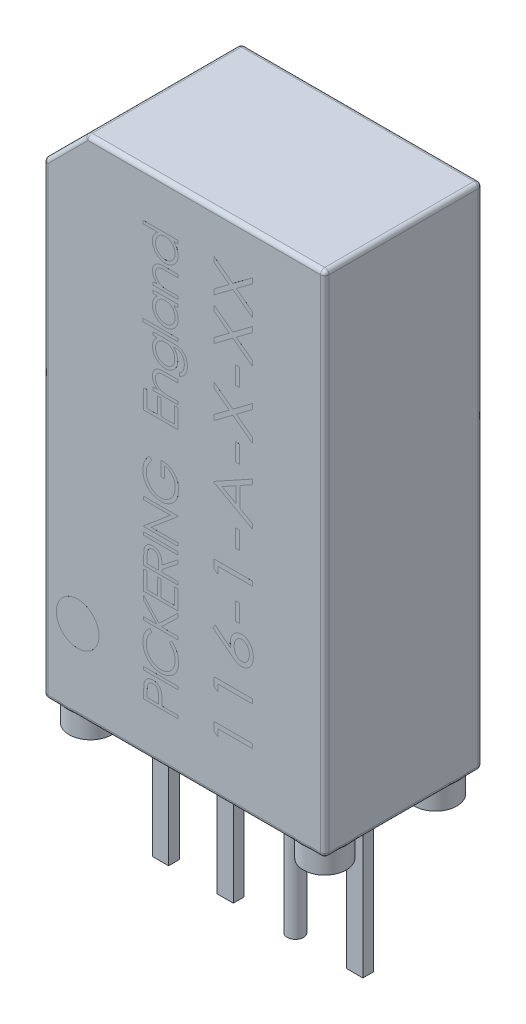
SolidWorks part; units mm, degrees
ref_plane "Front Plane" through (0, 0, 0) normal (0, 0, 1) x (1, 0, 0)
ref_plane "Top Plane" through (0, 0, 0) normal (0, 1, 0) x (1, 0, 0)
ref_plane "Right Plane" through (0, 0, 0) normal (1, 0, 0) x (0, 0, -1)
sketch "Sketch1" plane through (0, 0, 0) normal (0, 1, 0) x (1, 0, 0)
  line L1 (3.3, -1.85) -> (-3.3, -1.85)
  line L2 (3.3, -1.85) -> (3.3, 1.85)
  line L3 (3.3, 1.85) -> (-3.3, 1.85)
  line L4 (-3.3, -1.85) -> (-3.3, 1.85)
  line L5 (3.3, -1.85) -> (-3.3, 1.85) construction
  line L6 (3.3, 1.85) -> (-3.3, -1.85) construction
  point P0 (0, 0)
  dimension "D1" = 3.7
  dimension "D2" = 6.6
extrude "Main body" add sketch "Sketch1" along normal blind 11.942
sketch "Sketch2" plane through (0, 0, 1.85) normal (0, 0, 1) x (1, 0, 0)
  line L0 (-2.3, 11.942) -> (-3.3, 10.942)
  line L1 (-3.3, 11.942) -> (3.3, 11.942) construction
  line L2 (-3.3, 11.942) -> (-3.3, 0) construction
  line L3 (-3.3, 10.942) -> (-3.3, 11.942)
  line L4 (-3.3, 11.942) -> (-2.3, 11.942)
  dimension "D1" = 45
  dimension "D2" = 5.6
extrude "Box style cut" cut sketch "Sketch2" against normal through all
sketch "Sketch3" plane through (0, 0, 0) normal (0, -1, 0) x (1, 0, 0)
  line L0 (-3.3, 1.85) -> (3.3, 1.85) construction
  line L1 (-3.3, -1.85) -> (-3.3, 1.85) construction
  line L2 (3.3, -1.85) -> (-3.3, -1.85) construction
  line L3 (3.3, 1.85) -> (3.3, -1.85) construction
  circle A0 centre (-2.75, 1.3) radius 0.5
  circle A1 centre (-2.75, -1.3) radius 0.5
  circle A2 centre (2.75, -1.3) radius 0.5
  circle A3 centre (2.75, 1.3) radius 0.5
  dimension "D1" = 1
  dimension "D4" = 1
  dimension "D7" = 1
  dimension "D9" = 1
  dimension "D2" = 0.55
  dimension "D3" = 0.55
  dimension "D5" = 0.55
  dimension "D6" = 0.55
  dimension "D8" = 0.55
extrude "Feet" add sketch "Sketch3" along normal blind 0.508
sketch "Sketch4" plane through (0, 0, 0) normal (0, -1, 0) x (1, 0, 0)
  line L0 (-3.3, -1.85) -> (-3.3, 1.85) construction
  line L1 (-2.0895, -0.127) -> (-2.4705, -0.127)
  line L2 (-2.0895, -0.127) -> (-2.0895, 0.127)
  line L3 (-2.0895, 0.127) -> (-2.4705, 0.127)
  line L4 (-2.4705, -0.127) -> (-2.4705, 0.127)
  line L5 (-2.0895, -0.127) -> (-2.4705, 0.127) construction
  line L6 (-2.0895, 0.127) -> (-2.4705, -0.127) construction
  line L8 (-0.5695, -0.127) -> (-0.9505, -0.127)
  line L9 (-0.5695, -0.127) -> (-0.5695, 0.127)
  line L10 (-0.5695, 0.127) -> (-0.9505, 0.127)
  line L11 (-0.9505, -0.127) -> (-0.9505, 0.127)
  line L12 (-0.5695, -0.127) -> (-0.9505, 0.127) construction
  line L13 (-0.5695, 0.127) -> (-0.9505, -0.127) construction
  line L19 (2.4705, -0.127) -> (2.0895, -0.127)
  line L20 (2.4705, -0.127) -> (2.4705, 0.127)
  line L21 (2.4705, 0.127) -> (2.0895, 0.127)
  line L22 (2.0895, -0.127) -> (2.0895, 0.127)
  line L23 (2.4705, -0.127) -> (2.0895, 0.127) construction
  line L24 (2.4705, 0.127) -> (2.0895, -0.127) construction
  circle A0 centre (0.76, 0) radius 0.1905
  point P0 (-2.28, 0)
  point P7 (-0.76, 0)
  point P15 (2.28, 0)
  dimension "D3" = 0.381
  dimension "D1" = 0.381
  dimension "D2" = 0.254
  dimension "D4" = 1.52
  dimension "D5" = 0.381
  dimension "D6" = 1.52
  dimension "D7" = 0.381
  dimension "D8" = 0.254
  dimension "D9" = 1.52
  dimension "D12" = 1.02
extrude "Pins" add sketch "Sketch4" along normal blind 3.678
sketch "Sketch5" plane through (0, 0, 1.85) normal (0, 0, 1) x (1, 0, 0)
  line L0 (-0.15, 1.042) -> (-0.15, 11.042) construction
  line L1 (1.6, 1.042) -> (1.6, 11.042) construction
  line L2 (-2.3, 11.942) -> (3.3, 11.942) construction
  line L3 (-3.3, 10.942) -> (-3.3, 0) construction
  line L4 (-3.3, 0) -> (3.3, 0) construction
  circle A0 centre (-2.5, 1.9) radius 0.5
  text T0 "PICKERING   England" font "Century Gothic" height 0.8
  text T1 "116-1-A-X-XX" font "Century Gothic" height 0.9
  dimension "D5" = 1
  dimension "D1" = 10
  dimension "D2" = 0.9
  dimension "D3" = 3.15
  dimension "D4" = 1.75
  dimension "D6" = 1.9
  dimension "D7" = 0.8
extrude "Lettering" add sketch "Sketch5" along normal blind 0.0001
fillet "Fillet1" radius 0.1 15 edges at (0.5, 11.942, 1.85) (-2.3, 11.942, 0) (-2.8, 11.442, 1.85) (3.3, 5.971, 1.85) (3.3, 11.942, 0) (3.3, 0, 0) (0, 0, -1.85) (3.3, 5.971, -1.85) (0.5, 11.942, -1.85) (-2.8, 11.442, -1.85) (-3.3, 0, 0) (-3.3, 5.471, -1.85) (-3.3, 10.942, 0) (-3.3, 5.471, 1.85) (0, 0, 1.85)
